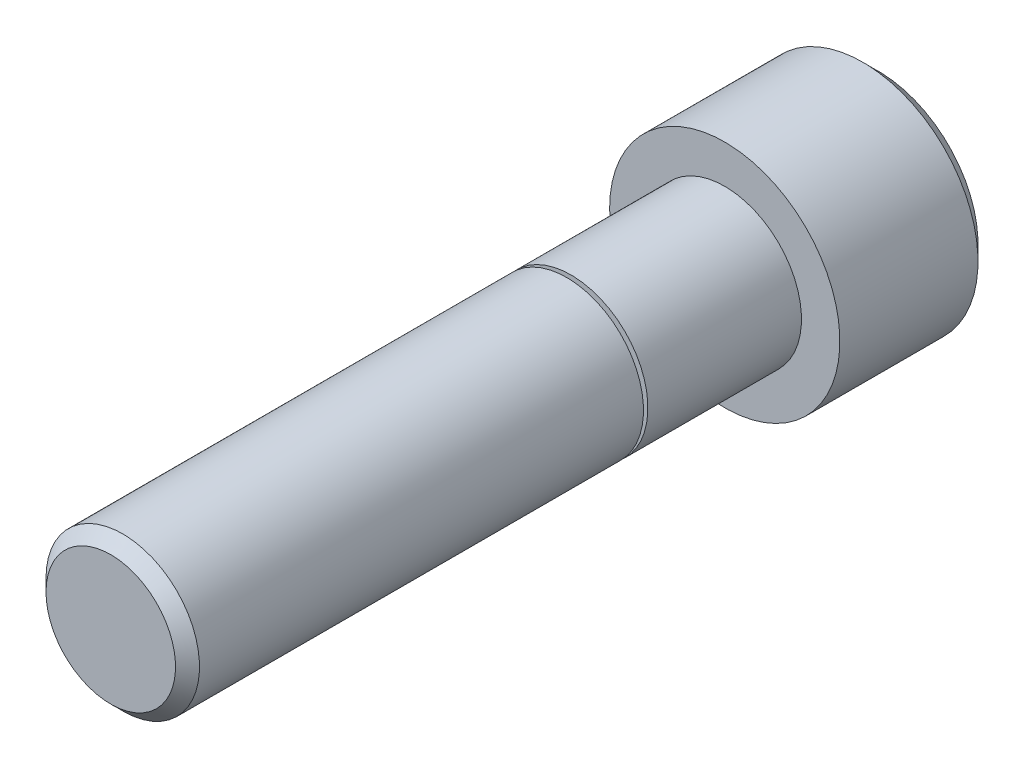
SolidWorks part; units mm, degrees
ref_plane "Front" through (0, 0, 0) normal (0, 0, 1) x (1, 0, 0)
ref_plane "Top" through (0, 0, 0) normal (0, 1, 0) x (1, 0, 0)
ref_plane "Right" through (0, 0, 0) normal (1, 0, 0) x (0, 0, -1)
sketch "Logo3_Revol_Axis" plane through (0, 0, 0) normal (0, 1, 0) x (1, 0, 0)
  line L0 (0, -43.5172) -> (0, 43.5172) construction
sketch "Logo3_bib1" plane through (0, 0, 0) normal (0, -1, 0) x (-1, 0, 0)
  line L0 (0, -50.8) -> (0, 12.7)
  line L1 (0, 12.7) -> (8.255, 12.7)
  line L2 (9.525, 11.43) -> (9.525, 0)
  line L3 (9.525, 0) -> (6.35, 0)
  line L4 (6.35, 0) -> (6.35, -12.71)
  line L5 (6.35, -49.8081) -> (5.3581, -50.8)
  line L6 (5.3581, -50.8) -> (0, -50.8)
  line L7 (6.35, -12.71) -> (5.4716, -12.71)
  line L8 (5.4647, -12.7488) -> (6.35, -13.071)
  line L9 (6.35, -13.071) -> (6.35, -49.8081)
  line L10 (0, 10.5852) -> (0, -63.2873) construction
  line L11 (8.255, 12.7) -> (9.525, 11.43)
  arc A1 (5.4716, -12.71) -> (5.4647, -12.7488) centre (5.4716, -12.73) ccw
  point P17 (5.3581, -12.71)
  point P19 (9.525, 12.7)
revolve "Revolve1" add sketch "Logo3_bib1" angle 360 about L10
sketch "Logo3_bib2" plane through (0, 0, -12.7) normal (0, 0, -1) x (1, 0, 0)
  line L1 (5.4993, 0) -> (2.7496, 4.7625)
  line L2 (2.7496, 4.7625) -> (-2.7496, 4.7625)
  line L3 (-2.7496, 4.7625) -> (-5.4993, 0)
  line L4 (-5.4993, 0) -> (-2.7496, -4.7625)
  line L5 (-2.7496, -4.7625) -> (2.7496, -4.7625)
  line L6 (2.7496, -4.7625) -> (5.4993, 0)
  circle A0 centre (0, 0) radius 4.7625 construction
  dimension "Logo3_c1" = 9.525
extrude "Cut-Extrude1" cut sketch "Logo3_bib2" against normal blind 6.35
equation "\"DIA2@Logo3_bib1\" = \"Logo3_d1-pas@Logo3_bib1\""
equation "\"LGT1@Logo3_bib1\" = \"Logo3_d1@Logo3_bib1\""
equation "\"D1@Cut-Extrude1\" = \"Logo3_d1@Logo3_bib1\"/2."
equation "\"D2@Cosmetic Thread1\" = \"Logo3_d1-pas@Logo3_bib1\""
equation "\"D5@Logo3_bib1\"=\"Logo3_d1@Logo3_bib1\"*.1"
